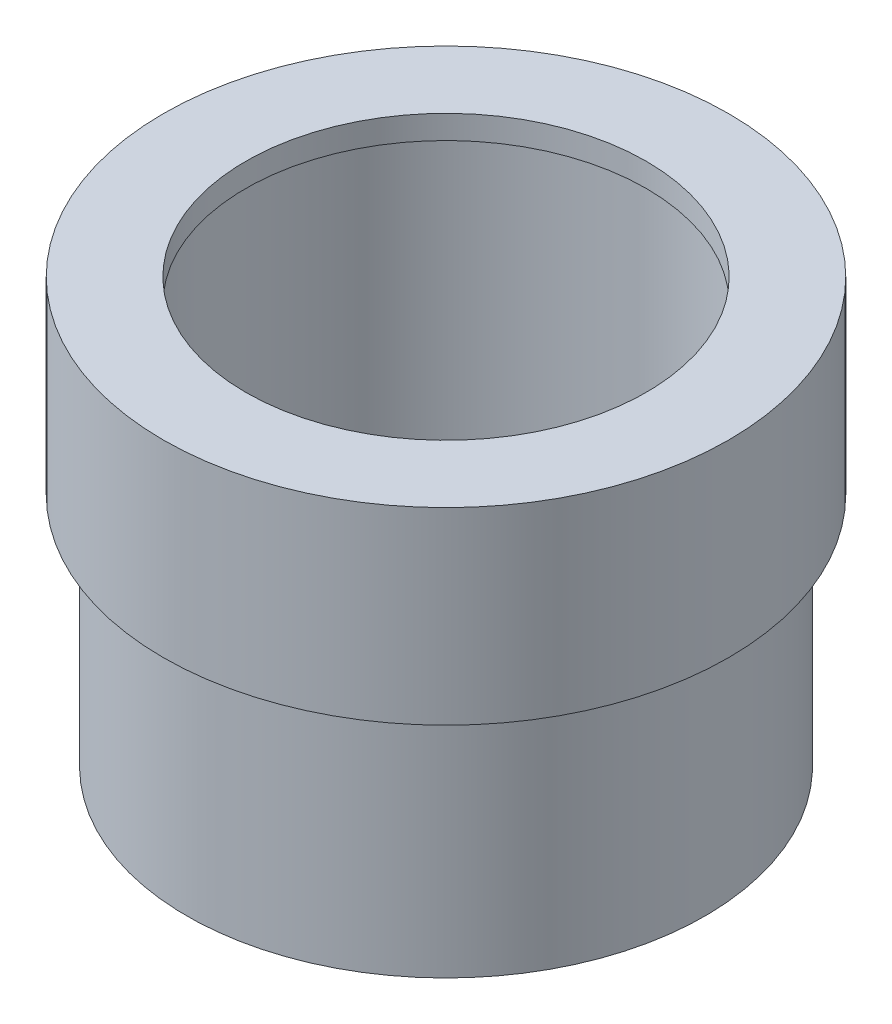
SolidWorks part; units mm, degrees
ref_plane "Front Plane" through (0, 0, 0) normal (0, 0, 1) x (1, 0, 0)
ref_plane "Top Plane" through (0, 0, 0) normal (0, 1, 0) x (1, 0, 0)
ref_plane "Right Plane" through (0, 0, 0) normal (1, 0, 0) x (0, 0, -1)
sketch "Sketch1" plane through (0, 0, 0) normal (0, 0, 1) x (1, 0, 0)
  line L0 (14.2875, 0) -> (14.2875, 26.9875)
  line L1 (14.2875, 26.9875) -> (13.4937, 26.9875)
  line L2 (13.4937, 26.9875) -> (13.4937, 28.575)
  line L3 (13.4937, 28.575) -> (19.05, 28.575)
  line L4 (19.05, 28.575) -> (19.05, 15.875)
  line L5 (19.05, 15.875) -> (17.4625, 15.875)
  line L6 (17.4625, 15.875) -> (17.4625, 0)
  line L7 (17.4625, 0) -> (14.2875, 0)
  line L8 (0, 0) -> (0, 20.1369) construction
  dimension "D1" = 34.925
  dimension "D2" = 28.575
  dimension "D3" = 26.9875
  dimension "D4" = 15.875
  dimension "D5" = 12.7
  dimension "D6" = 1.5875
  dimension "D7" = 38.1
revolve "Revolve1" add sketch "Sketch1" angle 360 about L8
